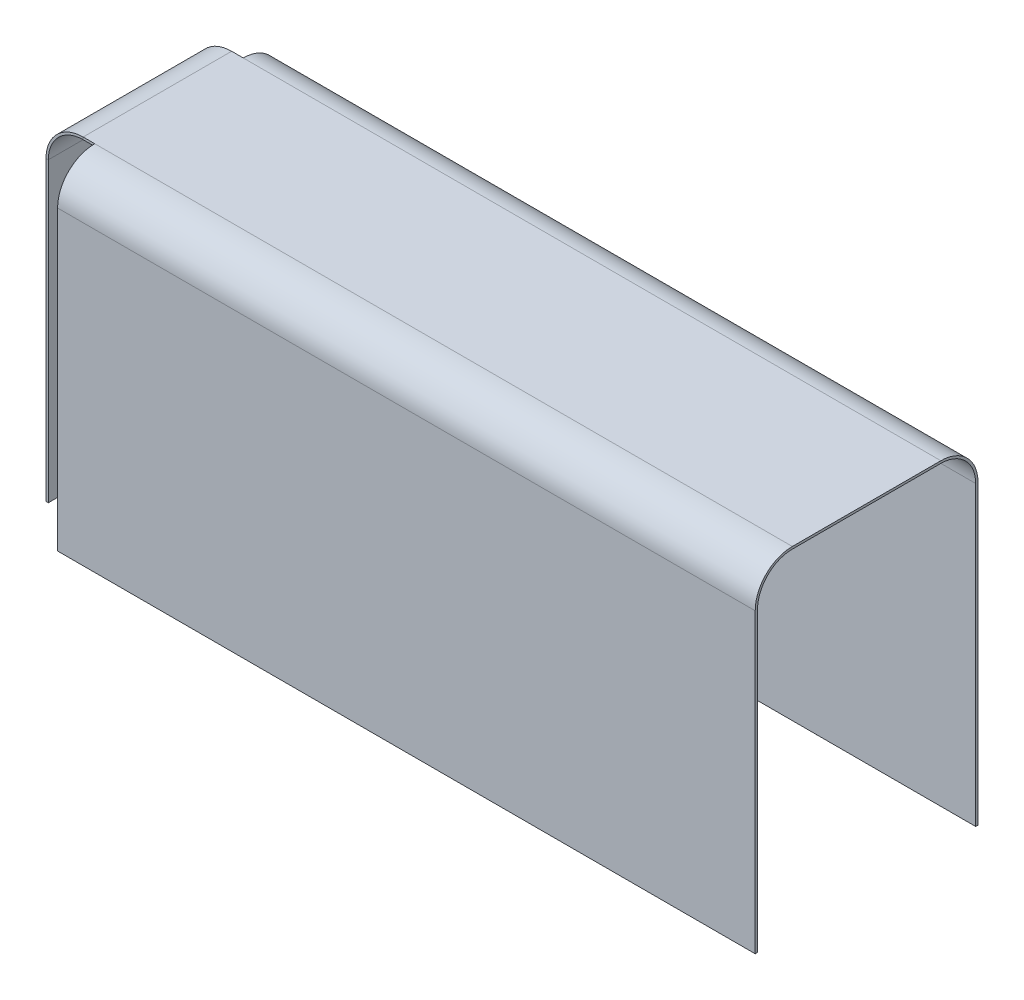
SolidWorks part; units mm, degrees
ref_plane "Front Plane" through (0, 0, 0) normal (0, 0, 1) x (1, 0, 0)
ref_plane "Top Plane" through (0, 0, 0) normal (0, 1, 0) x (1, 0, 0)
ref_plane "Right Plane" through (0, 0, 0) normal (1, 0, 0) x (0, 0, -1)
sketch "Sketch1" plane through (0, 0, 0) normal (0, 1, 0) x (1, 0, 0)
  line L1 (-119.2943, -38.1) -> (119.2943, -38.1)
  line L2 (-119.2943, -38.1) -> (-119.2943, 38.1)
  line L3 (-119.2943, 38.1) -> (119.2943, 38.1)
  line L4 (119.2943, -38.1) -> (119.2943, 38.1)
  point P4 (-119.2943, 0)
  point P5 (0, 38.1)
  dimension "D1" = 238.5885
  dimension "D2" = 76.2
extrude "Boss-Extrude1" add sketch "Sketch1" along normal blind 114.3
fillet "Fillet1" radius 12.7 2 edges at (0, 114.3, -38.1) (0, 114.3, 38.1)
shell "Shell1" thickness 0.7937
sketch "Sketch2" plane through (-119.2943, 0, 0) normal (-1, 0, 0) x (0, 0, 1)
  line L0 (-25.4, 113.5063) -> (25.4, 113.5063) construction
  line L1 (-25.4, 114.3) -> (25.4, 114.3)
  line L2 (-25.4, 114.3) -> (-25.4, 113.5063)
  line L3 (-25.4, 113.5063) -> (25.4, 113.5063)
  line L4 (25.4, 114.3) -> (25.4, 113.5063)
  point P0 (-25.4, 114.3)
  point P1 (25.4, 114.3)
sketch "Sketch3" plane through (0, 0, 0) normal (0, 0, 1) x (1, 0, 0)
  line L0 (-135.963, 0) -> (-135.963, 101.6)
  line L1 (-119.2943, 101.6) -> (-119.2943, 0) construction
  line L2 (-119.2943, 0) -> (119.2943, 0) construction
  line L3 (-119.2943, 114.3) -> (-123.263, 114.3)
  arc A0 (-135.963, 101.6) -> (-123.263, 114.3) centre (-123.263, 101.6) cw
  dimension "D2" = 12.7
  dimension "D1" = 16.6687
sweep "Sweep1" add profiles "Sketch2" path "Sketch3"
sketch "Sketch4" plane through (-135.963, 0, 0) normal (-1, 0, 0) x (0, 0, 1)
  line L0 (0, -55) -> (0, 55) construction
  line L2 (25.4, 0) -> (-25.4, 0) construction
  circle A0 centre (0, 22.5425) radius 2.54
  dimension "D1" = 5.08
  dimension "D2" = 22.5425
extrude "Cut-Extrude1" cut sketch "Sketch4" against normal blind 2.54
